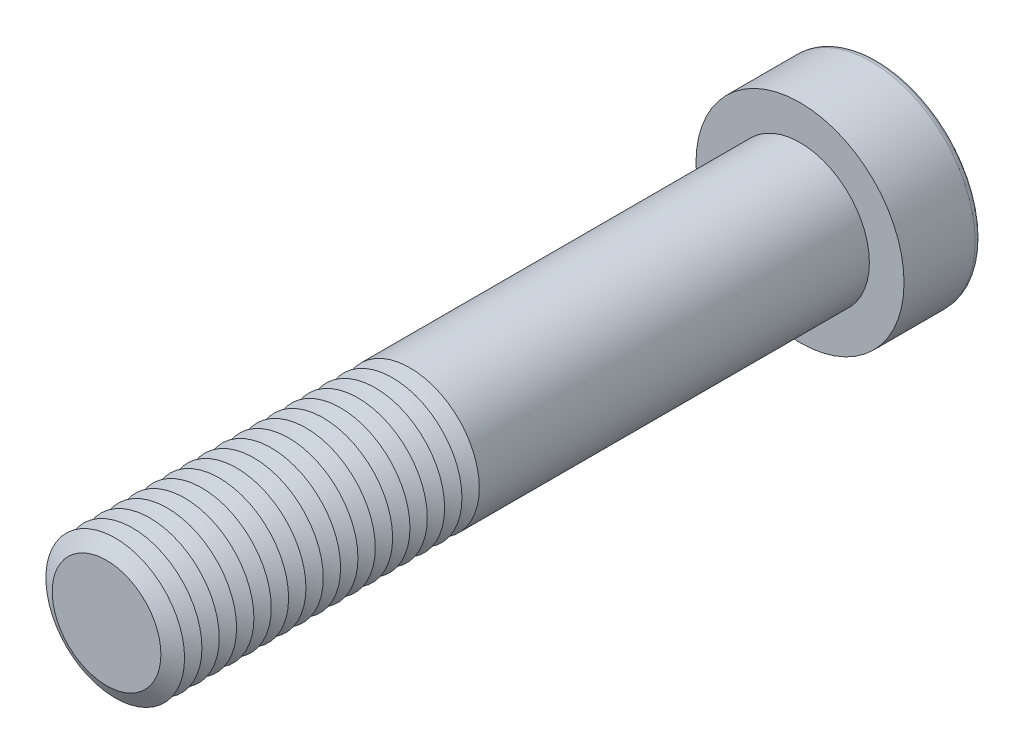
SolidWorks part; units mm, degrees
ref_plane "Front Plane" through (0, 0, 0) normal (0, 0, 1) x (1, 0, 0)
ref_plane "Top Plane" through (0, 0, 0) normal (0, 1, 0) x (1, 0, 0)
ref_plane "Right Plane" through (0, 0, 0) normal (1, 0, 0) x (0, 0, -1)
sketch "Sketch1" plane through (0, 0, 0) normal (0, 0, 1) x (1, 0, 0)
  circle A0 centre (0, 0) radius 8
  dimension "D1" = 16
extrude "Boss-Extrude1" add sketch "Sketch1" along normal blind 80
sketch "Sketch2" plane through (0, 0, 0) normal (0, 0, -1) x (-1, 0, 0)
  circle A0 centre (0, 0) radius 12
  dimension "D1" = 24
extrude "Boss-Extrude2" add sketch "Sketch2" along normal blind 9
sketch "Sketch3" plane through (0, 0, -9) normal (0, 0, -1) x (-1, 0, 0)
  line L1 (-3.4641, 6) -> (-6.9282, 0)
  line L2 (-6.9282, 0) -> (-3.4641, -6)
  line L3 (-3.4641, -6) -> (3.4641, -6)
  line L4 (3.4641, -6) -> (6.9282, 0)
  line L5 (6.9282, 0) -> (3.4641, 6)
  line L6 (3.4641, 6) -> (-3.4641, 6)
  circle A0 centre (0, 0) radius 6 construction
  dimension "D1" = 12
extrude "Cut-Extrude1" cut sketch "Sketch3" against normal blind 9
fillet "Fillet1" radius 0.8 1 edges at (-12, 0, -9)
sketch "Sketch4" plane through (0, 0, 0) normal (0, 0, -1) x (-1, 0, 0)
  line L0 (3.4641, -6) -> (6.9282, 0) construction
  circle A0 centre (0, 0) radius 6
extrude "Cut-Extrude2" cut sketch "Sketch4" against normal through all draft 60
sketch "Sketch5" plane through (0, 0, -9) normal (0, 0, -1) x (-1, 0, 0)
  circle A0 centre (0, 0) radius 6.9282
extrude "Cut-Extrude3" cut sketch "Sketch5" against normal through all draft 75
sketch "Sketch7" plane through (0, 0, 0) normal (1, 0, 0) x (0, 0, -1)
  line L25 (-80, 6.2679) -> (-79, 8)
  line L26 (-80, 8) -> (-80, -8) construction
  line L27 (-79, 8) -> (-81, 8)
  line L28 (-81, 8) -> (-80, 6.2679)
  line L29 (0, 8) -> (-80, 8) construction
  dimension "D1" = 2
revolve "Cut-Revolve1" cut sketch "Sketch7" angle 360 about axis through (0, 0, 80) along (0, 0, -1)
pattern_linear "LPattern1" count 18 spacing 2 along (0, 0, -1) of "Cut-Revolve1"
